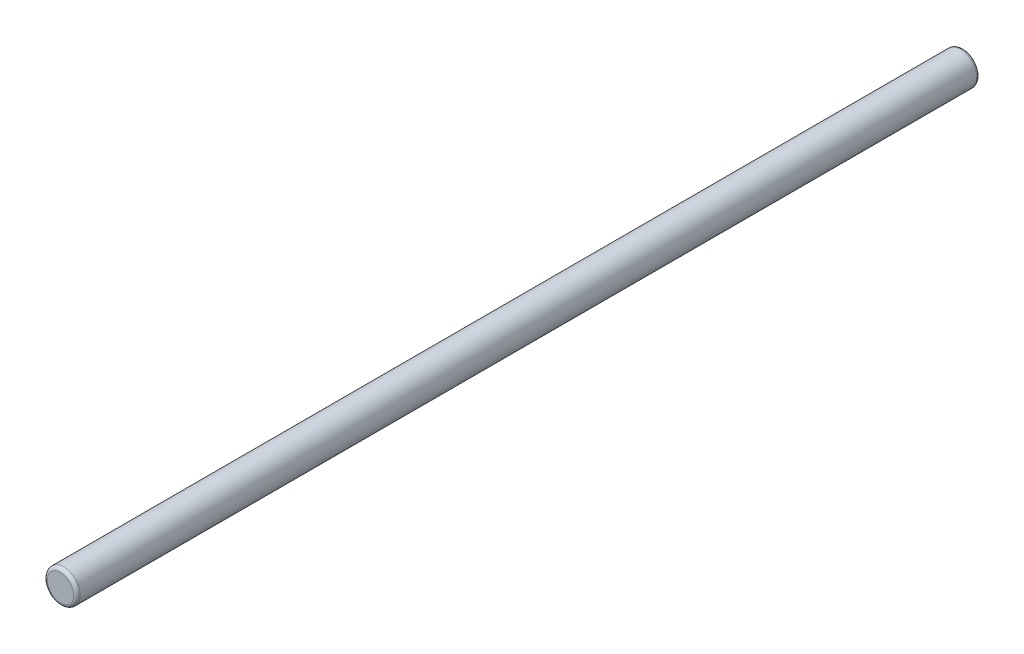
SolidWorks part; units mm, degrees
ref_plane "Front Plane" through (0, 0, 0) normal (0, 0, 1) x (1, 0, 0)
ref_plane "Top Plane" through (0, 0, 0) normal (0, 1, 0) x (1, 0, 0)
ref_plane "Right Plane" through (0, 0, 0) normal (1, 0, 0) x (0, 0, -1)
sketch "Sketch1" plane through (0, 0, 0) normal (0, 0, 1) x (1, 0, 0)
  circle A0 centre (0, 0) radius 5
  dimension "D1" = 10
extrude "Boss-Extrude1" add sketch "Sketch1" along normal mid plane 275
fillet "Fillet1" radius 1 2 edges at (5, 0, -137.5) (5, 0, 137.5)
